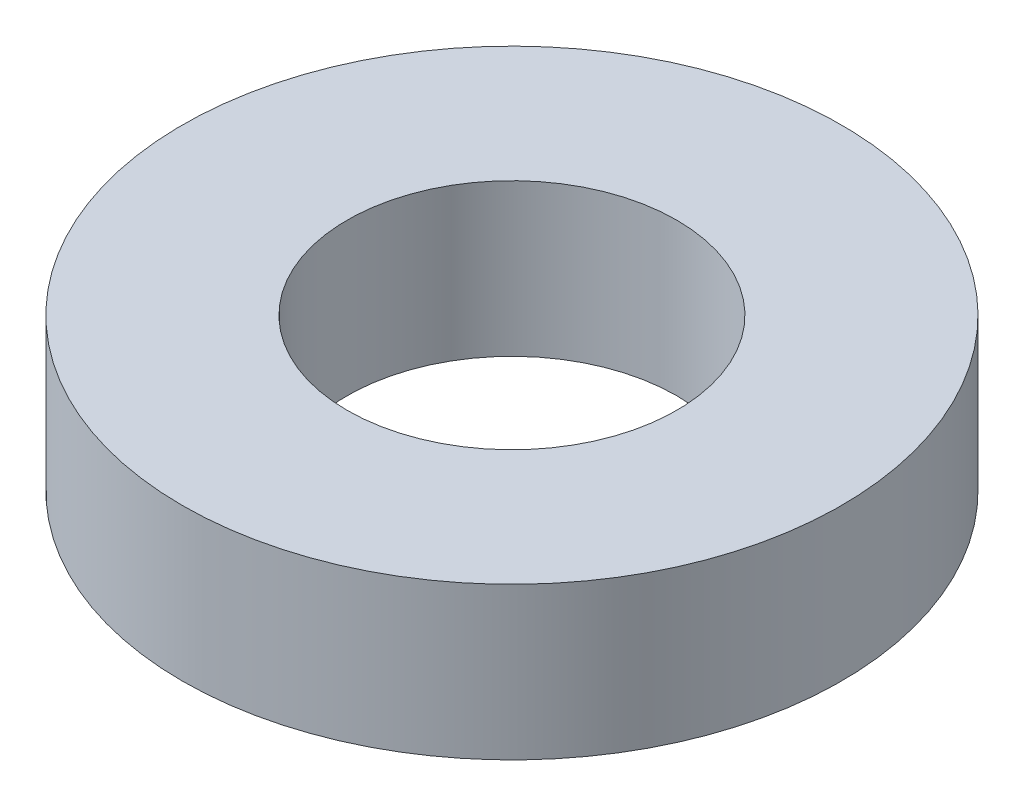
SolidWorks part; units mm, degrees
ref_plane "Alzado" through (0, 0, 0) normal (0, 0, 1) x (1, 0, 0)
ref_plane "Planta" through (0, 0, 0) normal (0, 1, 0) x (1, 0, 0)
ref_plane "Vista lateral" through (0, 0, 0) normal (1, 0, 0) x (0, 0, -1)
sketch "Sketch1" plane through (0, 0, 0) normal (0, 1, 0) x (1, 0, 0)
  circle A0 centre (0, 0) radius 3.25
  circle A1 centre (0, 0) radius 6.5
  dimension "D1" = 6.5
  dimension "D2" = 13
extrude "Boss-Extrude1" add sketch "Sketch1" along normal blind 3
